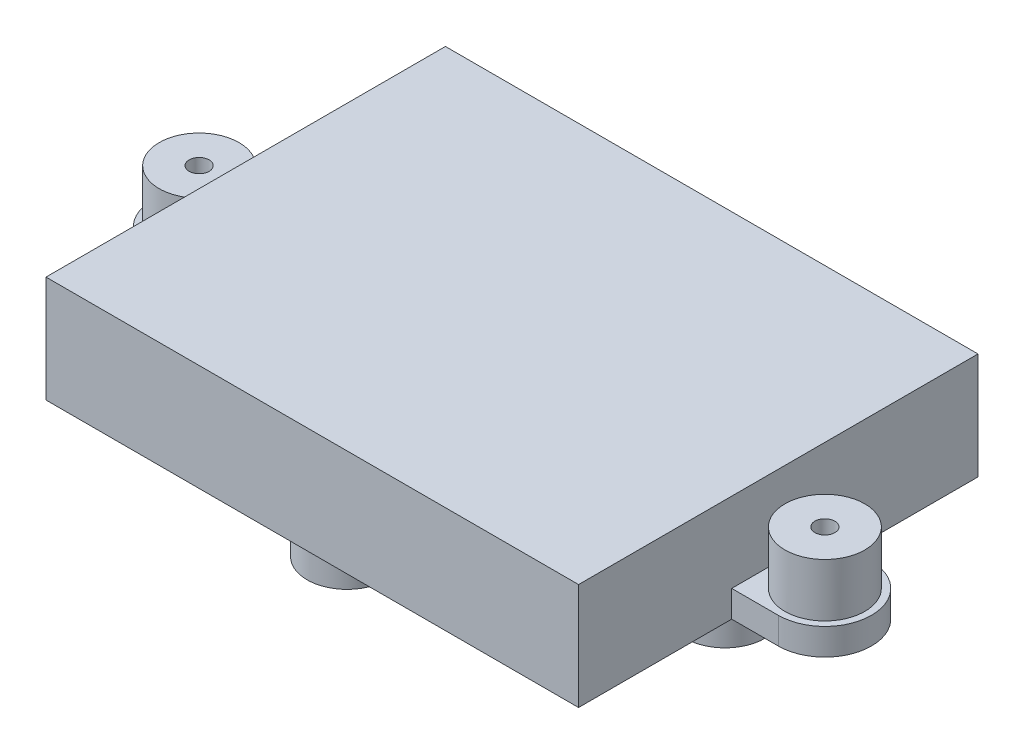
SolidWorks part; units mm, degrees
ref_plane "Face" through (0, 0, 0) normal (0, 0, 1) x (1, 0, 0)
ref_plane "Dessus" through (0, 0, 0) normal (0, 1, 0) x (1, 0, 0)
ref_plane "Droite" through (0, 0, 0) normal (1, 0, 0) x (0, 0, -1)
sketch "Esquisse1" plane through (0, 0, 0) normal (0, 0, 1) x (1, 0, 0)
  line L0 (0, 0) -> (28, 0) construction
  line L1 (-28, 4) -> (28, 4)
  line L2 (-28, 4) -> (-28, -4)
  line L3 (-28, -4) -> (28, -4)
  line L4 (28, 4) -> (28, -4)
  line L5 (0, 0) -> (0, -4) construction
  dimension "D1" = 56
  dimension "D2" = 8
extrude "Prisme de base" add sketch "Esquisse1" along normal mid plane 30
sketch "Esquisse2" plane through (28, 0, 0) normal (1, 0, 0) x (0, 0, -1)
  line L0 (15, -4) -> (15, 4) construction
  line L1 (-15, 4) -> (15, 4)
  line L2 (-15, 4) -> (-15, -2)
  line L3 (-15, -2) -> (15, -2)
  line L4 (15, 4) -> (15, -2)
  line L5 (-15, -4) -> (15, -4) construction
  dimension "D1" = 2
extrude "Epaulement" cut sketch "Esquisse2" against normal blind 8
sketch "Esquisse3" plane through (0, -2, 0) normal (0, 1, 0) x (-1, 0, 0)
  line L0 (-28, 15) -> (-28, -15) construction
  line L1 (0, 0) -> (-39.1736, 0) construction
  circle A0 centre (-23.5, 0) radius 3
  dimension "D1" = 6
  dimension "D3" = 4.5
extrude "Bossage" add sketch "Esquisse3" along normal blind 4
sketch "Esquisse4" plane through (0, 2, 0) normal (0, 1, 0) x (-1, 0, 0)
  circle A0 centre (-23.5, 0) radius 0.75
  circle A1 centre (-23.5, 0) radius 3 construction
  dimension "D1" = 1.5
extrude "Passage" cut sketch "Esquisse4" against normal through all
mirror "Symétrie1" about plane through (0, 0, 0) normal (0, 0, 1) of "Passage", "Bossage"
mirror "Symétrie2" about plane through (0, 0, 0) normal (1, 0, 0) of "Epaulement", "Symétrie1", "Bossage", "Passage"
sketch "Esquisse5" plane through (0, -4, 0) normal (0, -1, 0) x (1, 0, 0)
  circle A0 centre (4, 0) radius 12
  dimension "D1" = 24
  dimension "D2" = 4
extrude "Extrusion2" add sketch "Esquisse5" along normal blind 2
sketch "Esquisse6" plane through (0, -4, 0) normal (0, -1, 0) x (1, 0, 0)
  circle A0 centre (16, 0) radius 3
  circle A1 centre (4, 0) radius 12 construction
  dimension "D2" = 6
  dimension "D1" = 12
extrude "Extrusion3" add sketch "Esquisse6" along normal blind 3.5
pattern_circular "Répétition circulaire1" count 3 over 360 about axis through (4, 0, 0) along (0, 1, 0) of "Extrusion3"
sketch "Esquisse7" plane through (0, -2, 0) normal (0, 1, 0) x (-1, 0, 0)
  line L0 (-25.2796, 0) -> (-37.431, 0) construction
  line L1 (-23.5, -5.3575) -> (-23.5, 6.4788) construction
  line L2 (-20, -3.5) -> (-23.5, -3.5)
  line L3 (-20, 15) -> (-20, -15) construction
  line L4 (-20, 3.5) -> (-23.5, 3.5)
  line L5 (-20, -3.5) -> (-20, -15)
  line L6 (-20, -15) -> (-28, -15)
  line L7 (-28, -15) -> (-28, 15)
  line L8 (-28, 15) -> (-20, 15)
  line L9 (-20, 15) -> (-20, 3.5)
  circle A0 centre (-23.5, 0) radius 0.75 construction
  arc A1 (-23.5, -3.5) -> (-23.5, 3.5) centre (-23.5, 0) cw
  point P6 (-23.5, 0)
  dimension "D1" = 3.5
extrude "Enlèv. mat.-Extru.1" cut sketch "Esquisse7" against normal through all
mirror "Symétrie3" about plane through (0, 0, 0) normal (1, 0, 0) of "Enlèv. mat.-Extru.1"
